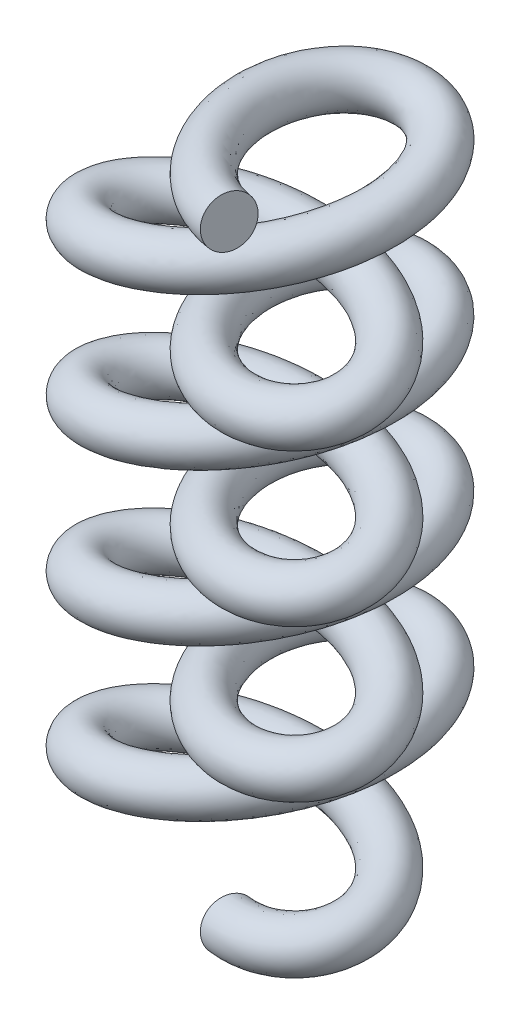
SolidWorks part; units mm, degrees
ref_plane "Front Plane" through (0, 0, 0) normal (0, 0, 1) x (1, 0, 0)
ref_plane "Top Plane" through (0, 0, 0) normal (0, 1, 0) x (1, 0, 0)
ref_plane "Right Plane" through (0, 0, 0) normal (1, 0, 0) x (0, 0, -1)
sketch3d "3DSketch1"
  spline S0 degree 4 number of poles 265 (-0.5568, -0.72, 7.0483) -> (10.6332, 64.8, 9.6353) construction
  spline S1 degree 4 number of poles 245 (5, 0, 10) -> (5, 64, 10)
ref_plane "Plane1" through (5, 0, 10) normal (0.9628, 0.1226, 0.2407) x (0.2388, 0.0304, -0.9706)
sketch "Sketch1" plane through (5, 0, 10) normal (0.9628, 0.1226, 0.2407) x (0.2388, 0.0304, -0.9706)
  circle A0 centre (0, 0) radius 2.5
  dimension "D1" = 5
sweep "Sweep1" add profiles "Sketch1" path "3DSketch1"
